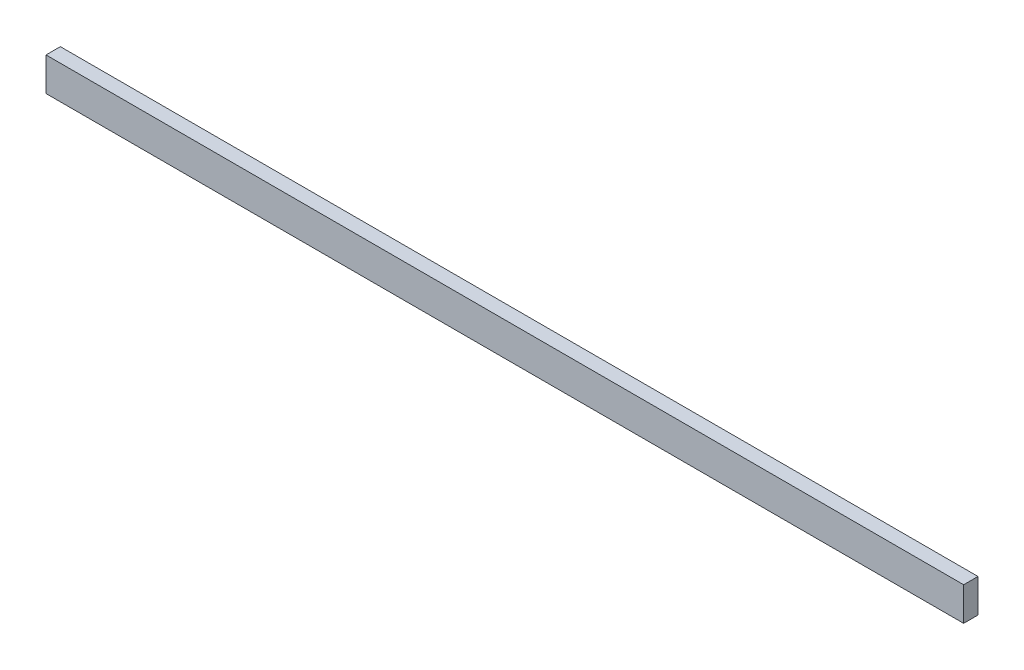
SolidWorks part; units mm, degrees
ref_plane "Front Plane" through (0, 0, 0) normal (0, 0, 1) x (1, 0, 0)
ref_plane "Top Plane" through (0, 0, 0) normal (0, 1, 0) x (1, 0, 0)
ref_plane "Right Plane" through (0, 0, 0) normal (1, 0, 0) x (0, 0, -1)
sketch "Sketch1" plane through (0, 0, 0) normal (1, 0, 0) x (0, 0, -1)
  line L1 (0, 0) -> (38.1, 0)
  line L2 (0, 0) -> (0, 88.9)
  line L3 (0, 88.9) -> (38.1, 88.9)
  line L4 (38.1, 0) -> (38.1, 88.9)
  dimension "D1" = 38.1
  dimension "D2" = 88.9
extrude "Extrude1" add sketch "Sketch1" along normal blind 2438.4
